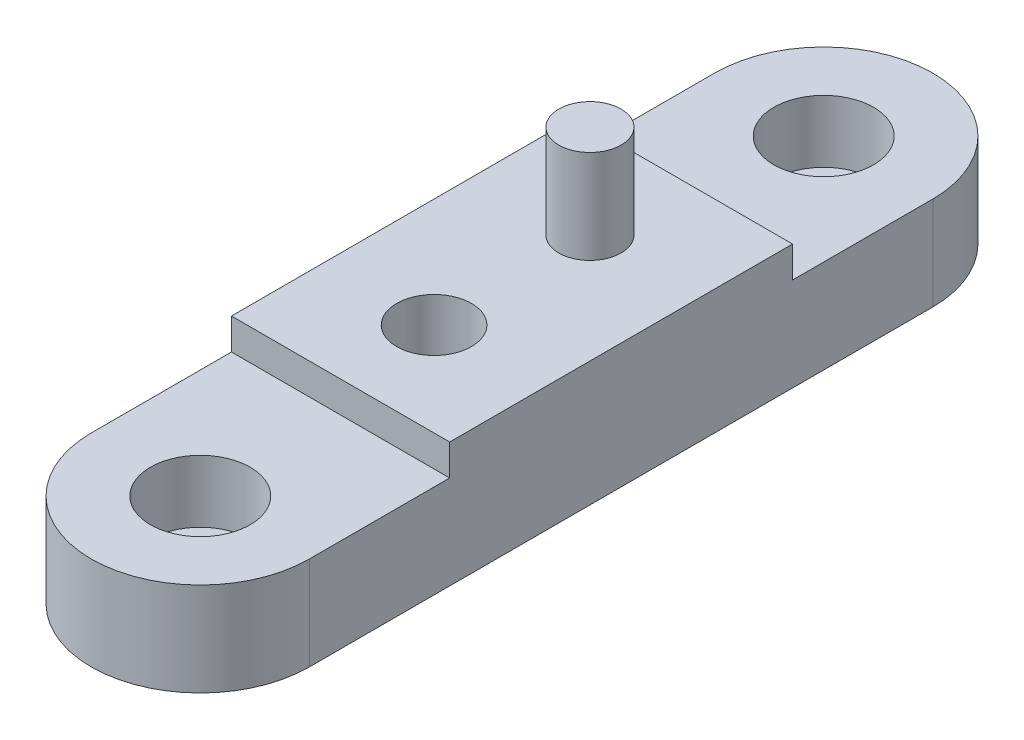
SolidWorks part; units mm, degrees
ref_plane "Front" through (0, 0, 0) normal (0, 0, 1) x (1, 0, 0)
ref_plane "Top" through (0, 0, 0) normal (0, 1, 0) x (1, 0, 0)
ref_plane "Right" through (0, 0, 0) normal (1, 0, 0) x (0, 0, -1)
sketch "Sketch1" plane through (0, 0, 0) normal (0, 1, 0) x (1, 0, 0)
  line L0 (0, 1.5) -> (-8.1896, 1.5) construction
  line L1 (0, 3.5) -> (-8.1896, 3.5) construction
  line L2 (-3.5, -10) -> (3.5, -10)
  line L3 (-3.5, 0) -> (3.5, 0) construction
  line L4 (-3.5, 0) -> (-3.5, -10)
  line L6 (3.5, 0) -> (3.5, -10)
  circle A0 centre (0, 0) radius 1.5 construction
  arc A1 (3.5, 0) -> (-3.5, 0) centre (0, 0) ccw
  dimension "D1" = 3
  dimension "D2" = 2
  dimension "D3" = 10
extrude "Boss-Extrude1" add sketch "Sketch1" along normal blind 4
sketch "Sketch2" plane through (0, 4, 0) normal (0, 1, 0) x (1, 0, 0)
  line L0 (0, 0) -> (-11.0692, 0) construction
  line L1 (-3.5, -4.5) -> (3.5, -4.5)
  line L2 (-3.5, 0) -> (-3.5, -10) construction
  line L3 (3.5, -10) -> (3.5, 0) construction
  line L4 (-3.5, 0) -> (-3.5, -4.5)
  line L5 (3.5, 0) -> (3.5, -4.5)
  line L6 (0, -3.5) -> (-8.4344, -3.5) construction
  arc A0 (3.5, 0) -> (-3.5, 0) centre (0, 0) ccw construction
  arc A1 (3.5, 0) -> (-3.5, 0) centre (0, 0) ccw
  circle A2 centre (0, 0) radius 3.5 construction
  dimension "D1" = 1
extrude "Cut-Extrude1" cut sketch "Sketch2" against normal blind 1
sketch "Sketch3" plane through (0, 3, 0) normal (0, 1, 0) x (1, 0, 0)
  circle A0 centre (0, 0) radius 1.6
  dimension "D1" = 3.2
extrude "Cut-Extrude2" cut sketch "Sketch3" against normal blind 2
mirror "Mirror1" about plane through (-3.5, 4, 10) normal (0, 0, -1)
sketch "Sketch4" plane through (0, 4, 0) normal (0, 1, 0) x (1, 0, 0)
  line L0 (0, -4.5) -> (0, -15.5) construction
  line L1 (-3.5, -4.5) -> (3.5, -4.5) construction
  line L2 (-3.5, -15.5) -> (3.5, -15.5) construction
  line L3 (0, -10) -> (-6.044, -10) construction
  circle A0 centre (0, -7.5) radius 1
  dimension "D2" = 2
  dimension "D1" = 2.5
extrude "Boss-Extrude2" add sketch "Sketch4" along normal blind 3
sketch "Sketch5" plane through (0, 4, 0) normal (0, 1, 0) x (1, 0, 0)
  line L0 (0, -4.5) -> (0, -15.5) construction
  line L1 (-3.5, -4.5) -> (3.5, -4.5) construction
  line L2 (-3.5, -15.5) -> (3.5, -15.5) construction
  line L3 (0, -10) -> (-7.1463, -10) construction
  circle A0 centre (0, -12.5) radius 1.2
  dimension "D2" = 2.4
  dimension "D1" = 2.5
extrude "Cut-Extrude3" cut sketch "Sketch5" against normal blind 4
